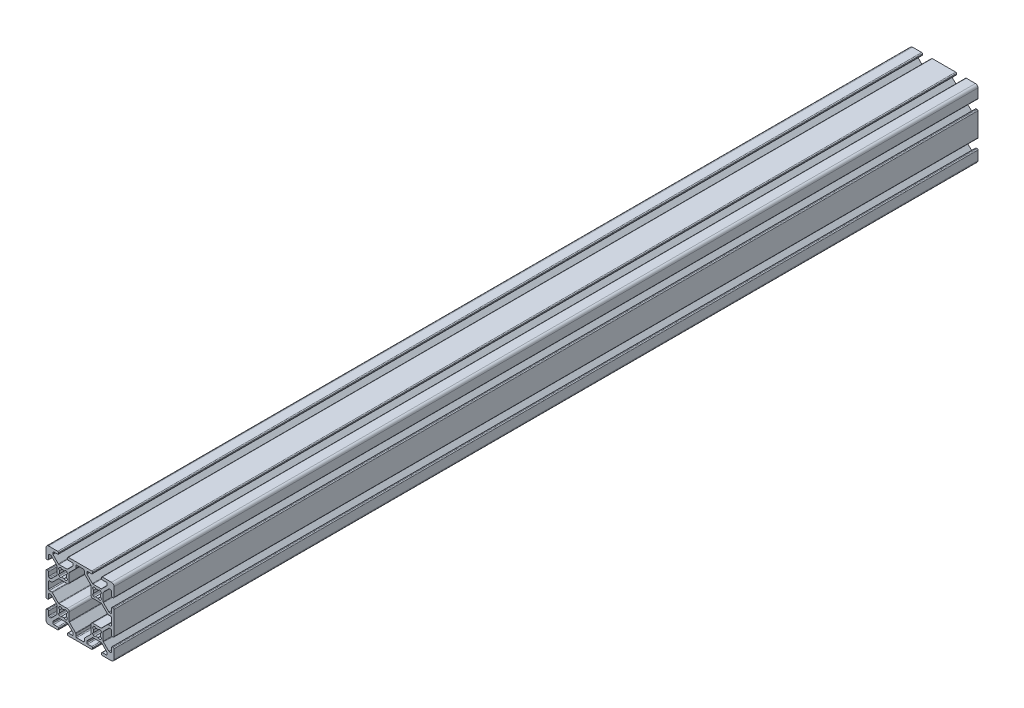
SolidWorks part; units mm, degrees
ref_plane "Front Plane" through (0, 0, 0) normal (0, 0, 1) x (1, 0, 0)
ref_plane "Top Plane" through (0, 0, 0) normal (0, 1, 0) x (1, 0, 0)
ref_plane "Right Plane" through (0, 0, 0) normal (1, 0, 0) x (0, 0, -1)
sketch "Sketch1" plane through (0, 0, 0) normal (0, 0, 1) x (1, 0, 0)
  line L0 (-16.6492, -131.4291) -> (-16.8288, -131.2495)
  line L1 (-16.8288, -126.9997) -> (-16.6492, -126.8201)
  line L2 (-12.3994, -126.8201) -> (-12.2198, -126.9997)
  line L3 (-12.2198, -131.2495) -> (-12.3994, -131.4291)
  line L4 (-36.6492, -131.4291) -> (-36.8288, -131.2495)
  line L5 (-36.8288, -126.9997) -> (-36.6492, -126.8201)
  line L6 (-32.3994, -126.8201) -> (-32.2198, -126.9997)
  line L7 (-32.2198, -131.2495) -> (-32.3994, -131.4291)
  line L8 (-16.6492, -151.4291) -> (-16.8288, -151.2495)
  line L9 (-16.8288, -146.9997) -> (-16.6492, -146.8201)
  line L10 (-12.3994, -146.8201) -> (-12.2198, -146.9997)
  line L11 (-12.2198, -151.2495) -> (-12.3994, -151.4291)
  line L12 (-27.0293, -157.1166) -> (-27.0293, -155.7694)
  line L13 (-27.1781, -155.4102) -> (-30.7205, -151.8677)
  line L14 (-30.8693, -151.5085) -> (-30.8693, -146.6126)
  line L15 (-32.0123, -145.4696) -> (-36.9082, -145.4696)
  line L16 (-37.2674, -145.3208) -> (-40.8098, -141.7784)
  line L17 (-41.169, -141.6296) -> (-42.5163, -141.6296)
  line L18 (-43.0243, -141.1216) -> (-43.0243, -137.1276)
  line L19 (-42.5163, -136.6196) -> (-41.169, -136.6196)
  line L20 (-40.8098, -136.4708) -> (-37.2674, -132.9284)
  line L21 (-36.9082, -132.7796) -> (-32.0123, -132.7796)
  line L22 (-30.8693, -131.6366) -> (-30.8693, -126.7407)
  line L23 (-30.7205, -126.3815) -> (-27.1781, -122.8391)
  line L24 (-27.0293, -122.4798) -> (-27.0293, -121.1326)
  line L25 (-26.5213, -120.6246) -> (-22.5273, -120.6246)
  line L26 (-22.0193, -121.1326) -> (-22.0193, -122.4798)
  line L27 (-21.8705, -122.8391) -> (-18.3281, -126.3815)
  line L28 (-18.1793, -126.7407) -> (-18.1793, -131.6366)
  line L29 (-17.0363, -132.7796) -> (-12.1404, -132.7796)
  line L30 (-11.7812, -132.9284) -> (-8.2387, -136.4708)
  line L31 (-7.8795, -136.6196) -> (-6.5323, -136.6196)
  line L32 (-6.0243, -137.1276) -> (-6.0243, -141.1216)
  line L33 (-6.5323, -141.6296) -> (-7.8795, -141.6296)
  line L34 (-8.2387, -141.7784) -> (-11.7812, -145.3208)
  line L35 (-12.1404, -145.4696) -> (-17.0363, -145.4696)
  line L36 (-18.1793, -146.6126) -> (-18.1793, -151.5085)
  line L37 (-18.3281, -151.8677) -> (-21.8705, -155.4102)
  line L38 (-22.0193, -155.7694) -> (-22.0193, -157.1166)
  line L39 (-22.5273, -157.6246) -> (-26.5213, -157.6246)
  line L40 (-36.6492, -151.4291) -> (-36.8288, -151.2495)
  line L41 (-36.8288, -146.9997) -> (-36.6492, -146.8201)
  line L42 (-32.3994, -146.8201) -> (-32.2198, -146.9997)
  line L43 (-32.2198, -151.2495) -> (-32.3994, -151.4291)
  line L44 (-36.9082, -152.7796) -> (-32.1404, -152.7796)
  line L45 (-31.7812, -152.9284) -> (-28.6781, -156.0315)
  line L46 (-28.5293, -156.3907) -> (-28.5293, -157.1166)
  line L47 (-29.0373, -157.6246) -> (-31.3863, -157.6246)
  line L48 (-31.8943, -158.1326) -> (-31.8943, -158.6166)
  line L49 (-31.3863, -159.1246) -> (-17.6623, -159.1246)
  line L50 (-17.1543, -158.6166) -> (-17.1543, -158.1326)
  line L51 (-17.6623, -157.6246) -> (-20.0113, -157.6246)
  line L52 (-20.5193, -157.1166) -> (-20.5193, -156.3907)
  line L53 (-20.3705, -156.0315) -> (-17.2674, -152.9284)
  line L54 (-16.9082, -152.7796) -> (-12.1404, -152.7796)
  line L55 (-11.7812, -152.9284) -> (-8.6781, -156.0315)
  line L56 (-8.5293, -156.3907) -> (-8.5293, -157.1166)
  line L57 (-9.0373, -157.6246) -> (-11.3863, -157.6246)
  line L58 (-11.8943, -158.1326) -> (-11.8943, -158.6166)
  line L59 (-11.3863, -159.1246) -> (-6.0243, -159.1246)
  line L60 (-4.5243, -157.6246) -> (-4.5243, -152.2626)
  line L61 (-5.0323, -151.7546) -> (-5.5163, -151.7546)
  line L62 (-6.0243, -152.2626) -> (-6.0243, -154.6116)
  line L63 (-6.5323, -155.1196) -> (-7.2582, -155.1196)
  line L64 (-7.6174, -154.9708) -> (-10.7205, -151.8677)
  line L65 (-10.8693, -151.5085) -> (-10.8693, -146.7407)
  line L66 (-10.7205, -146.3815) -> (-7.6174, -143.2784)
  line L67 (-7.2582, -143.1296) -> (-6.5323, -143.1296)
  line L68 (-6.0243, -143.6376) -> (-6.0243, -145.9866)
  line L69 (-5.5163, -146.4946) -> (-5.0323, -146.4946)
  line L70 (-4.5243, -145.9866) -> (-4.5243, -132.2626)
  line L71 (-5.0323, -131.7546) -> (-5.5163, -131.7546)
  line L72 (-6.0243, -132.2626) -> (-6.0243, -134.6116)
  line L73 (-6.5323, -135.1196) -> (-7.2582, -135.1196)
  line L74 (-7.6174, -134.9708) -> (-10.7205, -131.8677)
  line L75 (-10.8693, -131.5085) -> (-10.8693, -126.7407)
  line L76 (-10.7205, -126.3815) -> (-7.6174, -123.2784)
  line L77 (-7.2582, -123.1296) -> (-6.5323, -123.1296)
  line L78 (-6.0243, -123.6376) -> (-6.0243, -125.9866)
  line L79 (-5.5163, -126.4946) -> (-5.0323, -126.4946)
  line L80 (-4.5243, -125.9866) -> (-4.5243, -120.6246)
  line L81 (-6.0243, -119.1246) -> (-11.3863, -119.1246)
  line L82 (-11.8943, -119.6326) -> (-11.8943, -120.1166)
  line L83 (-11.3863, -120.6246) -> (-9.0373, -120.6246)
  line L84 (-8.5293, -121.1326) -> (-8.5293, -121.8585)
  line L85 (-8.6781, -122.2177) -> (-11.7812, -125.3208)
  line L86 (-12.1404, -125.4696) -> (-16.9082, -125.4696)
  line L87 (-17.2674, -125.3208) -> (-20.3705, -122.2177)
  line L88 (-20.5193, -121.8585) -> (-20.5193, -121.1326)
  line L89 (-20.0113, -120.6246) -> (-17.6623, -120.6246)
  line L90 (-17.1543, -120.1166) -> (-17.1543, -119.6326)
  line L91 (-17.6623, -119.1246) -> (-31.3863, -119.1246)
  line L92 (-31.8943, -119.6326) -> (-31.8943, -120.1166)
  line L93 (-31.3863, -120.6246) -> (-29.0373, -120.6246)
  line L94 (-28.5293, -121.1326) -> (-28.5293, -121.8585)
  line L95 (-28.6781, -122.2177) -> (-31.7812, -125.3208)
  line L96 (-32.1404, -125.4696) -> (-36.9082, -125.4696)
  line L97 (-37.2674, -125.3208) -> (-40.3705, -122.2177)
  line L98 (-40.5193, -121.8585) -> (-40.5193, -121.1326)
  line L99 (-40.0113, -120.6246) -> (-37.6623, -120.6246)
  line L100 (-37.1543, -120.1166) -> (-37.1543, -119.6326)
  line L101 (-37.6623, -119.1246) -> (-43.0243, -119.1246)
  line L102 (-44.5243, -120.6246) -> (-44.5243, -125.9866)
  line L103 (-44.0163, -126.4946) -> (-43.5323, -126.4946)
  line L104 (-43.0243, -125.9866) -> (-43.0243, -123.6376)
  line L105 (-42.5163, -123.1296) -> (-41.7904, -123.1296)
  line L106 (-41.4312, -123.2784) -> (-38.3281, -126.3815)
  line L107 (-38.1793, -126.7407) -> (-38.1793, -131.5085)
  line L108 (-38.3281, -131.8677) -> (-41.4312, -134.9708)
  line L109 (-41.7904, -135.1196) -> (-42.5163, -135.1196)
  line L110 (-43.0243, -134.6116) -> (-43.0243, -132.2626)
  line L111 (-43.5323, -131.7546) -> (-44.0163, -131.7546)
  line L112 (-44.5243, -132.2626) -> (-44.5243, -145.9866)
  line L113 (-44.0163, -146.4946) -> (-43.5323, -146.4946)
  line L114 (-43.0243, -145.9866) -> (-43.0243, -143.6376)
  line L115 (-42.5163, -143.1296) -> (-41.7904, -143.1296)
  line L116 (-41.4312, -143.2784) -> (-38.3281, -146.3815)
  line L117 (-38.1793, -146.7407) -> (-38.1793, -151.5085)
  line L118 (-38.3281, -151.8677) -> (-41.4312, -154.9708)
  line L119 (-41.7904, -155.1196) -> (-42.5163, -155.1196)
  line L120 (-43.0243, -154.6116) -> (-43.0243, -152.2626)
  line L121 (-43.5323, -151.7546) -> (-44.0163, -151.7546)
  line L122 (-44.5243, -152.2626) -> (-44.5243, -157.6246)
  line L123 (-43.0243, -159.1246) -> (-37.6623, -159.1246)
  line L124 (-37.1543, -158.6166) -> (-37.1543, -158.1326)
  line L125 (-37.6623, -157.6246) -> (-40.0113, -157.6246)
  line L126 (-40.5193, -157.1166) -> (-40.5193, -156.3907)
  line L127 (-40.3705, -156.0315) -> (-37.2674, -152.9284)
  arc A0 (-16.4594, -129.9286) -> (-16.8288, -131.2495) centre (-16.2723, -130.693) ccw
  arc A1 (-16.4594, -128.3206) -> (-16.4594, -129.9286) centre (-14.5243, -129.1246) ccw
  arc A2 (-16.8288, -126.9997) -> (-16.4594, -128.3206) centre (-16.2723, -127.5562) ccw
  arc A3 (-15.3283, -127.1895) -> (-16.6492, -126.8201) centre (-16.0927, -127.3766) ccw
  arc A4 (-13.7203, -127.1895) -> (-15.3283, -127.1895) centre (-14.5243, -129.1246) ccw
  arc A5 (-12.3994, -126.8201) -> (-13.7203, -127.1895) centre (-12.9559, -127.3766) ccw
  arc A6 (-12.5892, -128.3206) -> (-12.2198, -126.9997) centre (-12.7763, -127.5562) ccw
  arc A7 (-12.5892, -129.9286) -> (-12.5892, -128.3206) centre (-14.5243, -129.1246) ccw
  arc A8 (-12.2198, -131.2495) -> (-12.5892, -129.9286) centre (-12.7763, -130.693) ccw
  arc A9 (-13.7203, -131.0597) -> (-12.3994, -131.4291) centre (-12.9559, -130.8726) ccw
  arc A10 (-15.3283, -131.0597) -> (-13.7203, -131.0597) centre (-14.5243, -129.1246) ccw
  arc A11 (-16.6492, -131.4291) -> (-15.3283, -131.0597) centre (-16.0927, -130.8726) ccw
  arc A12 (-36.4594, -129.9286) -> (-36.8288, -131.2495) centre (-36.2723, -130.693) ccw
  arc A13 (-36.4594, -128.3206) -> (-36.4594, -129.9286) centre (-34.5243, -129.1246) ccw
  arc A14 (-36.8288, -126.9997) -> (-36.4594, -128.3206) centre (-36.2723, -127.5562) ccw
  arc A15 (-35.3283, -127.1895) -> (-36.6492, -126.8201) centre (-36.0927, -127.3766) ccw
  arc A16 (-33.7203, -127.1895) -> (-35.3283, -127.1895) centre (-34.5243, -129.1246) ccw
  arc A17 (-32.3994, -126.8201) -> (-33.7203, -127.1895) centre (-32.9559, -127.3766) ccw
  arc A18 (-32.5892, -128.3206) -> (-32.2198, -126.9997) centre (-32.7763, -127.5562) ccw
  arc A19 (-32.5892, -129.9286) -> (-32.5892, -128.3206) centre (-34.5243, -129.1246) ccw
  arc A20 (-32.2198, -131.2495) -> (-32.5892, -129.9286) centre (-32.7763, -130.693) ccw
  arc A21 (-33.7203, -131.0597) -> (-32.3994, -131.4291) centre (-32.9559, -130.8726) ccw
  arc A22 (-35.3283, -131.0597) -> (-33.7203, -131.0597) centre (-34.5243, -129.1246) ccw
  arc A23 (-36.6492, -131.4291) -> (-35.3283, -131.0597) centre (-36.0927, -130.8726) ccw
  arc A24 (-16.4594, -149.9286) -> (-16.8288, -151.2495) centre (-16.2723, -150.693) ccw
  arc A25 (-16.4594, -148.3206) -> (-16.4594, -149.9286) centre (-14.5243, -149.1246) ccw
  arc A26 (-16.8288, -146.9997) -> (-16.4594, -148.3206) centre (-16.2723, -147.5562) ccw
  arc A27 (-15.3283, -147.1895) -> (-16.6492, -146.8201) centre (-16.0927, -147.3766) ccw
  arc A28 (-13.7203, -147.1895) -> (-15.3283, -147.1895) centre (-14.5243, -149.1246) ccw
  arc A29 (-12.3994, -146.8201) -> (-13.7203, -147.1895) centre (-12.9559, -147.3766) ccw
  arc A30 (-12.5892, -148.3206) -> (-12.2198, -146.9997) centre (-12.7763, -147.5562) ccw
  arc A31 (-12.5892, -149.9286) -> (-12.5892, -148.3206) centre (-14.5243, -149.1246) ccw
  arc A32 (-12.2198, -151.2495) -> (-12.5892, -149.9286) centre (-12.7763, -150.693) ccw
  arc A33 (-13.7203, -151.0597) -> (-12.3994, -151.4291) centre (-12.9559, -150.8726) ccw
  arc A34 (-15.3283, -151.0597) -> (-13.7203, -151.0597) centre (-14.5243, -149.1246) ccw
  arc A35 (-16.6492, -151.4291) -> (-15.3283, -151.0597) centre (-16.0927, -150.8726) ccw
  arc A36 (-27.0293, -157.1166) -> (-26.5213, -157.6246) centre (-26.5213, -157.1166) ccw
  arc A37 (-27.0293, -155.7694) -> (-27.1781, -155.4102) centre (-27.5373, -155.7694) ccw
  arc A38 (-30.8693, -151.5085) -> (-30.7205, -151.8677) centre (-30.3613, -151.5085) ccw
  arc A39 (-30.8693, -146.6126) -> (-32.0123, -145.4696) centre (-32.0123, -146.6126) ccw
  arc A40 (-37.2674, -145.3208) -> (-36.9082, -145.4696) centre (-36.9082, -144.9616) ccw
  arc A41 (-40.8098, -141.7784) -> (-41.169, -141.6296) centre (-41.169, -142.1376) ccw
  arc A42 (-43.0243, -141.1216) -> (-42.5163, -141.6296) centre (-42.5163, -141.1216) ccw
  arc A43 (-42.5163, -136.6196) -> (-43.0243, -137.1276) centre (-42.5163, -137.1276) ccw
  arc A44 (-41.169, -136.6196) -> (-40.8098, -136.4708) centre (-41.169, -136.1116) ccw
  arc A45 (-36.9082, -132.7796) -> (-37.2674, -132.9284) centre (-36.9082, -133.2876) ccw
  arc A46 (-32.0123, -132.7796) -> (-30.8693, -131.6366) centre (-32.0123, -131.6366) ccw
  arc A47 (-30.7205, -126.3815) -> (-30.8693, -126.7407) centre (-30.3613, -126.7407) ccw
  arc A48 (-27.1781, -122.8391) -> (-27.0293, -122.4798) centre (-27.5373, -122.4798) ccw
  arc A49 (-26.5213, -120.6246) -> (-27.0293, -121.1326) centre (-26.5213, -121.1326) ccw
  arc A50 (-22.0193, -121.1326) -> (-22.5273, -120.6246) centre (-22.5273, -121.1326) ccw
  arc A51 (-22.0193, -122.4798) -> (-21.8705, -122.8391) centre (-21.5113, -122.4798) ccw
  arc A52 (-18.1793, -126.7407) -> (-18.3281, -126.3815) centre (-18.6873, -126.7407) ccw
  arc A53 (-18.1793, -131.6366) -> (-17.0363, -132.7796) centre (-17.0363, -131.6366) ccw
  arc A54 (-11.7812, -132.9284) -> (-12.1404, -132.7796) centre (-12.1404, -133.2876) ccw
  arc A55 (-8.2387, -136.4708) -> (-7.8795, -136.6196) centre (-7.8795, -136.1116) ccw
  arc A56 (-6.0243, -137.1276) -> (-6.5323, -136.6196) centre (-6.5323, -137.1276) ccw
  arc A57 (-6.5323, -141.6296) -> (-6.0243, -141.1216) centre (-6.5323, -141.1216) ccw
  arc A58 (-7.8795, -141.6296) -> (-8.2387, -141.7784) centre (-7.8795, -142.1376) ccw
  arc A59 (-12.1404, -145.4696) -> (-11.7812, -145.3208) centre (-12.1404, -144.9616) ccw
  arc A60 (-17.0363, -145.4696) -> (-18.1793, -146.6126) centre (-17.0363, -146.6126) ccw
  arc A61 (-18.3281, -151.8677) -> (-18.1793, -151.5085) centre (-18.6873, -151.5085) ccw
  arc A62 (-21.8705, -155.4102) -> (-22.0193, -155.7694) centre (-21.5113, -155.7694) ccw
  arc A63 (-22.5273, -157.6246) -> (-22.0193, -157.1166) centre (-22.5273, -157.1166) ccw
  arc A64 (-36.4594, -149.9286) -> (-36.8288, -151.2495) centre (-36.2723, -150.693) ccw
  arc A65 (-36.4594, -148.3206) -> (-36.4594, -149.9286) centre (-34.5243, -149.1246) ccw
  arc A66 (-36.8288, -146.9997) -> (-36.4594, -148.3206) centre (-36.2723, -147.5562) ccw
  arc A67 (-35.3283, -147.1895) -> (-36.6492, -146.8201) centre (-36.0927, -147.3766) ccw
  arc A68 (-33.7203, -147.1895) -> (-35.3283, -147.1895) centre (-34.5243, -149.1246) ccw
  arc A69 (-32.3994, -146.8201) -> (-33.7203, -147.1895) centre (-32.9559, -147.3766) ccw
  arc A70 (-32.5892, -148.3206) -> (-32.2198, -146.9997) centre (-32.7763, -147.5562) ccw
  arc A71 (-32.5892, -149.9286) -> (-32.5892, -148.3206) centre (-34.5243, -149.1246) ccw
  arc A72 (-32.2198, -151.2495) -> (-32.5892, -149.9286) centre (-32.7763, -150.693) ccw
  arc A73 (-33.7203, -151.0597) -> (-32.3994, -151.4291) centre (-32.9559, -150.8726) ccw
  arc A74 (-35.3283, -151.0597) -> (-33.7203, -151.0597) centre (-34.5243, -149.1246) ccw
  arc A75 (-36.6492, -151.4291) -> (-35.3283, -151.0597) centre (-36.0927, -150.8726) ccw
  arc A76 (-36.9082, -152.7796) -> (-37.2674, -152.9284) centre (-36.9082, -153.2876) ccw
  arc A77 (-31.7812, -152.9284) -> (-32.1404, -152.7796) centre (-32.1404, -153.2876) ccw
  arc A78 (-28.5293, -156.3907) -> (-28.6781, -156.0315) centre (-29.0373, -156.3907) ccw
  arc A79 (-29.0373, -157.6246) -> (-28.5293, -157.1166) centre (-29.0373, -157.1166) ccw
  arc A80 (-31.3863, -157.6246) -> (-31.8943, -158.1326) centre (-31.3863, -158.1326) ccw
  arc A81 (-31.8943, -158.6166) -> (-31.3863, -159.1246) centre (-31.3863, -158.6166) ccw
  arc A82 (-17.6623, -159.1246) -> (-17.1543, -158.6166) centre (-17.6623, -158.6166) ccw
  arc A83 (-17.1543, -158.1326) -> (-17.6623, -157.6246) centre (-17.6623, -158.1326) ccw
  arc A84 (-20.5193, -157.1166) -> (-20.0113, -157.6246) centre (-20.0113, -157.1166) ccw
  arc A85 (-20.3705, -156.0315) -> (-20.5193, -156.3907) centre (-20.0113, -156.3907) ccw
  arc A86 (-16.9082, -152.7796) -> (-17.2674, -152.9284) centre (-16.9082, -153.2876) ccw
  arc A87 (-11.7812, -152.9284) -> (-12.1404, -152.7796) centre (-12.1404, -153.2876) ccw
  arc A88 (-8.5293, -156.3907) -> (-8.6781, -156.0315) centre (-9.0373, -156.3907) ccw
  arc A89 (-9.0373, -157.6246) -> (-8.5293, -157.1166) centre (-9.0373, -157.1166) ccw
  arc A90 (-11.3863, -157.6246) -> (-11.8943, -158.1326) centre (-11.3863, -158.1326) ccw
  arc A91 (-11.8943, -158.6166) -> (-11.3863, -159.1246) centre (-11.3863, -158.6166) ccw
  arc A92 (-6.0243, -159.1246) -> (-4.5243, -157.6246) centre (-6.0243, -157.6246) ccw
  arc A93 (-4.5243, -152.2626) -> (-5.0323, -151.7546) centre (-5.0323, -152.2626) ccw
  arc A94 (-5.5163, -151.7546) -> (-6.0243, -152.2626) centre (-5.5163, -152.2626) ccw
  arc A95 (-6.5323, -155.1196) -> (-6.0243, -154.6116) centre (-6.5323, -154.6116) ccw
  arc A96 (-7.6174, -154.9708) -> (-7.2582, -155.1196) centre (-7.2582, -154.6116) ccw
  arc A97 (-10.8693, -151.5085) -> (-10.7205, -151.8677) centre (-10.3613, -151.5085) ccw
  arc A98 (-10.7205, -146.3815) -> (-10.8693, -146.7407) centre (-10.3613, -146.7407) ccw
  arc A99 (-7.2582, -143.1296) -> (-7.6174, -143.2784) centre (-7.2582, -143.6376) ccw
  arc A100 (-6.0243, -143.6376) -> (-6.5323, -143.1296) centre (-6.5323, -143.6376) ccw
  arc A101 (-6.0243, -145.9866) -> (-5.5163, -146.4946) centre (-5.5163, -145.9866) ccw
  arc A102 (-5.0323, -146.4946) -> (-4.5243, -145.9866) centre (-5.0323, -145.9866) ccw
  arc A103 (-4.5243, -132.2626) -> (-5.0323, -131.7546) centre (-5.0323, -132.2626) ccw
  arc A104 (-5.5163, -131.7546) -> (-6.0243, -132.2626) centre (-5.5163, -132.2626) ccw
  arc A105 (-6.5323, -135.1196) -> (-6.0243, -134.6116) centre (-6.5323, -134.6116) ccw
  arc A106 (-7.6174, -134.9708) -> (-7.2582, -135.1196) centre (-7.2582, -134.6116) ccw
  arc A107 (-10.8693, -131.5085) -> (-10.7205, -131.8677) centre (-10.3613, -131.5085) ccw
  arc A108 (-10.7205, -126.3815) -> (-10.8693, -126.7407) centre (-10.3613, -126.7407) ccw
  arc A109 (-7.2582, -123.1296) -> (-7.6174, -123.2784) centre (-7.2582, -123.6376) ccw
  arc A110 (-6.0243, -123.6376) -> (-6.5323, -123.1296) centre (-6.5323, -123.6376) ccw
  arc A111 (-6.0243, -125.9866) -> (-5.5163, -126.4946) centre (-5.5163, -125.9866) ccw
  arc A112 (-5.0323, -126.4946) -> (-4.5243, -125.9866) centre (-5.0323, -125.9866) ccw
  arc A113 (-4.5243, -120.6246) -> (-6.0243, -119.1246) centre (-6.0243, -120.6246) ccw
  arc A114 (-11.3863, -119.1246) -> (-11.8943, -119.6326) centre (-11.3863, -119.6326) ccw
  arc A115 (-11.8943, -120.1166) -> (-11.3863, -120.6246) centre (-11.3863, -120.1166) ccw
  arc A116 (-8.5293, -121.1326) -> (-9.0373, -120.6246) centre (-9.0373, -121.1326) ccw
  arc A117 (-8.6781, -122.2177) -> (-8.5293, -121.8585) centre (-9.0373, -121.8585) ccw
  arc A118 (-12.1404, -125.4696) -> (-11.7812, -125.3208) centre (-12.1404, -124.9616) ccw
  arc A119 (-17.2674, -125.3208) -> (-16.9082, -125.4696) centre (-16.9082, -124.9616) ccw
  arc A120 (-20.5193, -121.8585) -> (-20.3705, -122.2177) centre (-20.0113, -121.8585) ccw
  arc A121 (-20.0113, -120.6246) -> (-20.5193, -121.1326) centre (-20.0113, -121.1326) ccw
  arc A122 (-17.6623, -120.6246) -> (-17.1543, -120.1166) centre (-17.6623, -120.1166) ccw
  arc A123 (-17.1543, -119.6326) -> (-17.6623, -119.1246) centre (-17.6623, -119.6326) ccw
  arc A124 (-31.3863, -119.1246) -> (-31.8943, -119.6326) centre (-31.3863, -119.6326) ccw
  arc A125 (-31.8943, -120.1166) -> (-31.3863, -120.6246) centre (-31.3863, -120.1166) ccw
  arc A126 (-28.5293, -121.1326) -> (-29.0373, -120.6246) centre (-29.0373, -121.1326) ccw
  arc A127 (-28.6781, -122.2177) -> (-28.5293, -121.8585) centre (-29.0373, -121.8585) ccw
  arc A128 (-32.1404, -125.4696) -> (-31.7812, -125.3208) centre (-32.1404, -124.9616) ccw
  arc A129 (-37.2674, -125.3208) -> (-36.9082, -125.4696) centre (-36.9082, -124.9616) ccw
  arc A130 (-40.5193, -121.8585) -> (-40.3705, -122.2177) centre (-40.0113, -121.8585) ccw
  arc A131 (-40.0113, -120.6246) -> (-40.5193, -121.1326) centre (-40.0113, -121.1326) ccw
  arc A132 (-37.6623, -120.6246) -> (-37.1543, -120.1166) centre (-37.6623, -120.1166) ccw
  arc A133 (-37.1543, -119.6326) -> (-37.6623, -119.1246) centre (-37.6623, -119.6326) ccw
  arc A134 (-43.0243, -119.1246) -> (-44.5243, -120.6246) centre (-43.0243, -120.6246) ccw
  arc A135 (-44.5243, -125.9866) -> (-44.0163, -126.4946) centre (-44.0163, -125.9866) ccw
  arc A136 (-43.5323, -126.4946) -> (-43.0243, -125.9866) centre (-43.5323, -125.9866) ccw
  arc A137 (-42.5163, -123.1296) -> (-43.0243, -123.6376) centre (-42.5163, -123.6376) ccw
  arc A138 (-41.4312, -123.2784) -> (-41.7904, -123.1296) centre (-41.7904, -123.6376) ccw
  arc A139 (-38.1793, -126.7407) -> (-38.3281, -126.3815) centre (-38.6873, -126.7407) ccw
  arc A140 (-38.3281, -131.8677) -> (-38.1793, -131.5085) centre (-38.6873, -131.5085) ccw
  arc A141 (-41.7904, -135.1196) -> (-41.4312, -134.9708) centre (-41.7904, -134.6116) ccw
  arc A142 (-43.0243, -134.6116) -> (-42.5163, -135.1196) centre (-42.5163, -134.6116) ccw
  arc A143 (-43.0243, -132.2626) -> (-43.5323, -131.7546) centre (-43.5323, -132.2626) ccw
  arc A144 (-44.0163, -131.7546) -> (-44.5243, -132.2626) centre (-44.0163, -132.2626) ccw
  arc A145 (-44.5243, -145.9866) -> (-44.0163, -146.4946) centre (-44.0163, -145.9866) ccw
  arc A146 (-43.5323, -146.4946) -> (-43.0243, -145.9866) centre (-43.5323, -145.9866) ccw
  arc A147 (-42.5163, -143.1296) -> (-43.0243, -143.6376) centre (-42.5163, -143.6376) ccw
  arc A148 (-41.4312, -143.2784) -> (-41.7904, -143.1296) centre (-41.7904, -143.6376) ccw
  arc A149 (-38.1793, -146.7407) -> (-38.3281, -146.3815) centre (-38.6873, -146.7407) ccw
  arc A150 (-38.3281, -151.8677) -> (-38.1793, -151.5085) centre (-38.6873, -151.5085) ccw
  arc A151 (-41.7904, -155.1196) -> (-41.4312, -154.9708) centre (-41.7904, -154.6116) ccw
  arc A152 (-43.0243, -154.6116) -> (-42.5163, -155.1196) centre (-42.5163, -154.6116) ccw
  arc A153 (-43.0243, -152.2626) -> (-43.5323, -151.7546) centre (-43.5323, -152.2626) ccw
  arc A154 (-44.0163, -151.7546) -> (-44.5243, -152.2626) centre (-44.0163, -152.2626) ccw
  arc A155 (-44.5243, -157.6246) -> (-43.0243, -159.1246) centre (-43.0243, -157.6246) ccw
  arc A156 (-37.6623, -159.1246) -> (-37.1543, -158.6166) centre (-37.6623, -158.6166) ccw
  arc A157 (-37.1543, -158.1326) -> (-37.6623, -157.6246) centre (-37.6623, -158.1326) ccw
  arc A158 (-40.5193, -157.1166) -> (-40.0113, -157.6246) centre (-40.0113, -157.1166) ccw
  arc A159 (-40.3705, -156.0315) -> (-40.5193, -156.3907) centre (-40.0113, -156.3907) ccw
extrude "Extrude1" add sketch "Sketch1" along normal blind 508
